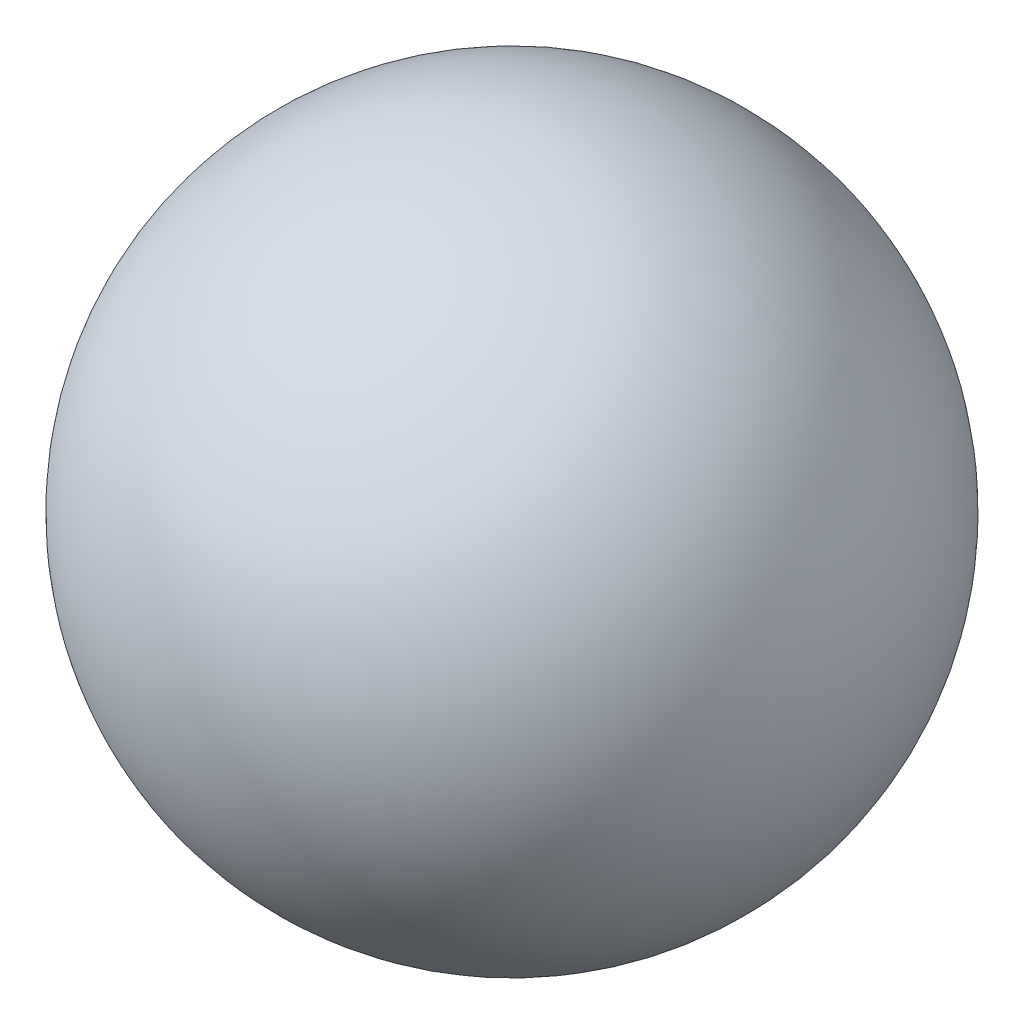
SolidWorks part; units mm, degrees
ref_plane "前视基准面" through (0, 0, 0) normal (0, 0, 1) x (1, 0, 0)
ref_plane "上视基准面" through (0, 0, 0) normal (0, 1, 0) x (1, 0, 0)
ref_plane "右视基准面" through (0, 0, 0) normal (1, 0, 0) x (0, 0, -1)
sketch "草图1" plane through (0, 0, 0) normal (0, 1, 0) x (1, 0, 0)
  line L0 (0, 31.7615) -> (0, -31.7615) construction
  line L1 (0, 8.5) -> (0, -8.5)
  arc A0 (0, -8.5) -> (0, 8.5) centre (0, 0) ccw
  dimension "D1" = 17
revolve "旋转1" add sketch "草图1" angle 360 about L0
